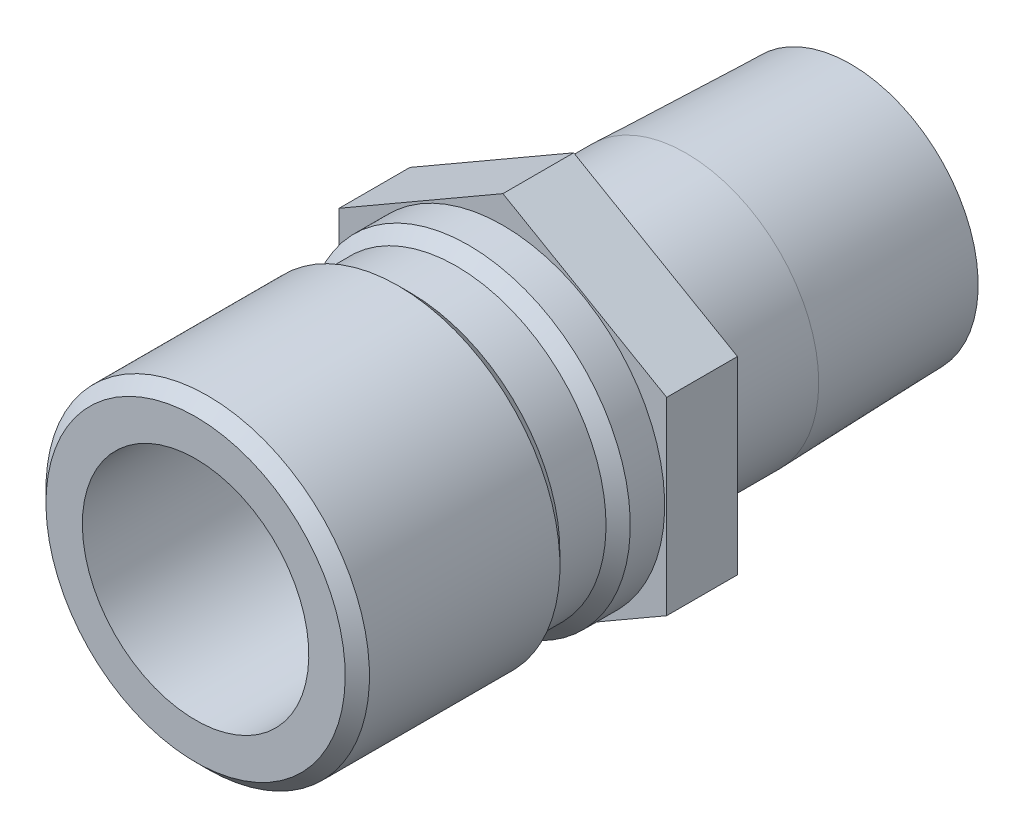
SolidWorks part; units mm, degrees
ref_plane "Front Plane" through (0, 0, 0) normal (0, 0, 1) x (1, 0, 0)
ref_plane "Top Plane" through (0, 0, 0) normal (0, 1, 0) x (1, 0, 0)
ref_plane "Right Plane" through (0, 0, 0) normal (1, 0, 0) x (0, 0, -1)
sketch "Sketch1" plane through (0, 0, 0) normal (1, 0, 0) x (0, 0, -1)
  line L0 (0, 0) -> (-22.479, 0) construction
  line L1 (-19.304, 7.112) -> (-19.304, 9.398)
  line L2 (-5.8166, 9.398) -> (-5.8166, 0) construction
  line L3 (-18.542, 10.16) -> (-6.5786, 10.16)
  line L4 (0, 8.3312) -> (0, 0) construction
  line L5 (-5.8166, 9.398) -> (-2.921, 9.398)
  line L6 (-2.159, 10.16) -> (0, 10.16)
  line L7 (0, 10.16) -> (0, 8.3312)
  line L8 (-5.8166, 9.398) -> (-6.5786, 10.16)
  line L9 (-2.921, 9.398) -> (-2.159, 10.16)
  line L10 (-19.304, 9.398) -> (-18.542, 10.16)
  line L11 (-1.0716, 6.2611) -> (21.844, 6.2611)
  line L12 (0, 8.3312) -> (11.5062, 8.3312)
  line L13 (11.5062, 8.3312) -> (21.844, 8.0081)
  line L14 (21.844, 8.0081) -> (21.844, 6.2611)
  line L15 (4.445, 0) -> (0, 0) construction
  line L16 (-19.304, 7.112) -> (-1.524, 7.112)
  line L17 (-1.524, 7.112) -> (-1.0716, 6.2611)
  dimension "D1" = 19.304
  dimension "D2" = 2.8956
  dimension "D3" = 0.762
  dimension "D4" = 45
  dimension "D5" = 13.4874
  dimension "D6" = 45
  dimension "D7" = 1.79
  dimension "D8" = 10.3378
  dimension "D9" = 41.148
  dimension "D10" = 3.175
  dimension "D11" = 4.445
  dimension "D12" = 12.5222
  dimension "D13" = 16.6624
  dimension "D14" = 20.32
  dimension "D15" = 118
  dimension "D16" = 14.224
  dimension "D17" = 17.78
revolve "Revolve1" add sketch "Sketch1" angle 360 about L0
sketch "Sketch2" plane through (0, 0, 0) normal (0, 0, 1) x (1, 0, 0)
  line L1 (-10.287, 5.9392) -> (-10.287, -5.9392)
  line L2 (-10.287, -5.9392) -> (0, -11.8784)
  line L3 (0, -11.8784) -> (10.287, -5.9392)
  line L4 (10.287, -5.9392) -> (10.287, 5.9392)
  line L5 (10.287, 5.9392) -> (0, 11.8784)
  line L6 (0, 11.8784) -> (-10.287, 5.9392)
  circle A0 centre (0, 0) radius 10.287 construction
  circle A1 centre (0, 0) radius 6.2611 construction
  circle A2 centre (0, 0) radius 6.2611
  dimension "D1" = 20.574
extrude "Boss-Extrude1" add sketch "Sketch2" against normal up to vertex (4.445 mm away)
